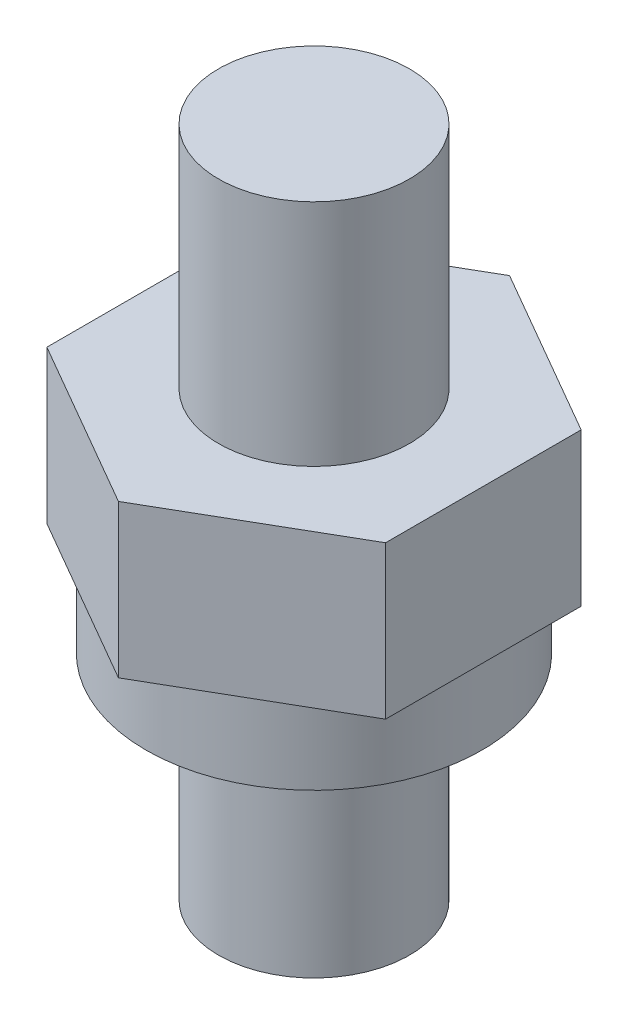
SolidWorks part; units mm, degrees
ref_plane "Front Plane" through (0, 0, 0) normal (0, 0, 1) x (1, 0, 0)
ref_plane "Top Plane" through (0, 0, 0) normal (0, 1, 0) x (1, 0, 0)
ref_plane "Right Plane" through (0, 0, 0) normal (1, 0, 0) x (0, 0, -1)
sketch "Sketch1" plane through (0, 0, 0) normal (0, 1, 0) x (1, 0, 0)
  circle A0 centre (0, 0) radius 3.9688
extrude "Extrude1" add sketch "Sketch1" along normal blind 8.89
sketch "Sketch2" plane through (0, 8.89, 0) normal (0, 1, 0) x (1, 0, 0)
  circle A0 centre (0, 0) radius 6.985
extrude "Extrude2" add sketch "Sketch2" along normal blind 3.175
sketch "Sketch3" plane through (0, 12.065, 0) normal (0, 1, 0) x (1, 0, 0)
  line L0 (0, -8.128) -> (0, 8.128) construction
  line L1 (0, 0) -> (7.0391, 4.064) construction
  line L2 (0, 0) -> (7.0391, -4.064) construction
  line L3 (7.0391, 4.064) -> (0, 8.128)
  line L4 (7.0391, 4.064) -> (7.0391, -4.064)
  line L5 (7.0391, -4.064) -> (0, -8.128)
  line L6 (-7.0391, -4.064) -> (0, -8.128)
  line L7 (-7.0391, 4.064) -> (-7.0391, -4.064)
  line L8 (-7.0391, 4.064) -> (0, 8.128)
  dimension "D1" = 60
extrude "Extrude3" add sketch "Sketch3" along normal blind 6.35
sketch "Sketch4" plane through (0, 18.415, 0) normal (0, 1, 0) x (1, 0, 0)
  circle A0 centre (0, 0) radius 3.9688
extrude "Extrude4" add sketch "Sketch4" along normal blind 9.525
